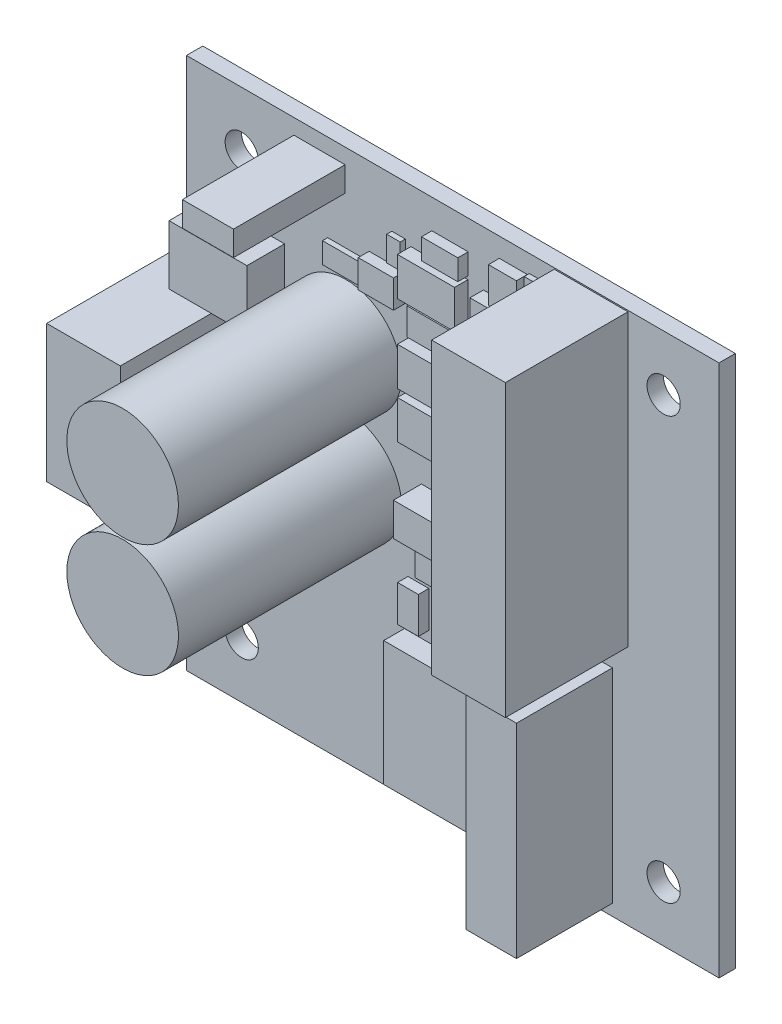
SolidWorks part; units mm, degrees
ref_plane "Front Plane" through (0, 0, 0) normal (0, 0, 1) x (1, 0, 0)
ref_plane "Top Plane" through (0, 0, 0) normal (0, 1, 0) x (1, 0, 0)
ref_plane "Right Plane" through (0, 0, 0) normal (1, 0, 0) x (0, 0, -1)
imported_body "10020689ra1_valve_actuator-1-surface1" [suppressed]
imported_body "MOLEX_705434PIN_705430003-1-surface1" [suppressed]
imported_body "MOLEX_705434PIN_705430003-2-surface1"
imported_body "RESC3225X60N_CRCW121051R0JNEA-1-surface1"
imported_body "TE_872242PIN_872242_SYMMOD1-1-surface1"
imported_body "TE_872242PIN_872242_SYMMOD1-2-surface1"
imported_body "SOIC127P594X3638N_HCPL0701-1-surface1"
imported_body "RESC2012X50N_CRCW0805100RJNEA-1-surface1"
imported_body "RESC2012X50N_CRCW0805100RJNEA-2-surface1"
imported_body "RESC2012X50N_CRCW0805100RJNEA-3-surface1"
imported_body "SOT65P205X1053N_132_BSS138W7F-1-surface1"
imported_body "SOT65P205X1053N_132_BSS138W7F-2-surface1"
imported_body "SOT65P205X1053N_132_BSS138W7F-3-surface1"
imported_body "SOP50P310X908N_SN74AUP1G74DCUR-1-surface1"
imported_body "SOP65P400X1308N_SN74AUP1G99DCTR_SYMMOD2-1-surface1"
imported_body "SOP65P400X1308N_SN74AUP1G99DCTR_SYMMOD2-2-surface1"
imported_body "SOP65P400X1308N_SN74AUP1G99DCTR_SYMMOD2-3-surface1"
imported_body "SOP65P400X1308N_SN74AUP1G99DCTR_SYMMOD3-1-surface1"
imported_body "SOP65P400X1308N_SN74AUP1G99DCTR_SYMMOD1-1-surface1"
imported_body "SOT65P280X1008N_LTC2934ITS81#TRMPBF-1-surface1"
imported_body "SOT65P280X1008N_LT3008ETS833#TRMPBF-1-surface1"
imported_body "DIOM5336X262N_SMBJ22A13F-1-surface1"
imported_body "DIOM5336X262N_SMBJ50A13F-1-surface1"
imported_body "DIOM5336X262N_SMBJ50A13F-2-surface1"
imported_body "CAPC1608X87N_C0603C104K5RAC-1-surface1"
imported_body "CAPC1608X87N_C0603C104K5RAC-2-surface1"
imported_body "CAPC1608X87N_C0603C104K5RAC-3-surface1"
imported_body "CAPC1608X87N_C0603C104K5RAC-4-surface1"
imported_body "SOT95P280X1005N_LT6003HS5#TRMPBF-1-surface1"
imported_body "CAPC2012X100N_C0805C105K4RAC-1-surface1"
imported_body "CAPC2012X100N_C0805C105K4RAC-2-surface1"
imported_body "CAPC2012X100N_C0805C105K4RAC-3-surface1"
imported_body "CAPC2012X100N_C0805C105K4RAC-4-surface1"
imported_body "CAPC2012X100N_C0805C105K4RAC-5-surface1"
imported_body "SOT92P240X120R3N_ACX_BAS197F-1-surface1"
imported_body "SOT92P240X120R3N_ACX_BAS197F-2-surface1"
imported_body "SOT92P240X120R3N_ACX_ZLLS1000TA-1-surface1"
imported_body "IND_MSS6132_MSS6132183MLB-1-surface1"
imported_body "CAPC2012X110N_C0805C474K5RAC-1-surface1"
imported_body "RESC1608X50N_CRCW060336K0JNEA-1-surface1"
imported_body "RESC1608X50N_CRCW060336K0JNEA-2-surface1"
imported_body "RESC1608X50N_CRCW060336K0JNEA-3-surface1"
imported_body "RESC1608X50N_CRCW0603330KJNEA-1-surface1"
imported_body "RESC1608X50N_CRCW06031M00JNEA-1-surface1"
imported_body "RESC1608X50N_CRCW060310K0JNEA-1-surface1"
imported_body "RESC1608X50N_CRCW060310K0JNEA-2-surface1"
imported_body "RESC1608X50N_CRCW0603154KFKEA-1-surface1"
imported_body "RESC1608X50N_CRCW06031M00FKEA-1-surface1"
imported_body "RESC1608X50N_CRCW06031M00FKEA-2-surface1"
imported_body "RESC1608X50N_CRCW06031M00FKEA-3-surface1"
imported_body "RESC1608X50N_CRCW06031M00FKEA-4-surface1"
imported_body "RESC1608X50N_CRCW060342K2FKEA-1-surface1"
imported_body "RESC1608X50N_CRCW06030000Z0EA-1-surface1"
imported_body "RESC1608X50N_CRCW0603100RJNEA-1-surface1"
imported_body "RESC1608X50N_CRCW0603562KFKEA-1-surface1"
imported_body "RESC1608X50N_CRCW060335K7FKEA-1-surface1"
imported_body "SOP50P490X11011N_MSEG_LT3991EMSE5#PBF-1-surface1"
imported_body "DIOM5336X250N_S1AB13F-1-surface1"
imported_body "IND_ACM4520_ACM45209012PT000-1-surface1"
imported_body "CAPC3325X270N_C1210X475K5RACTU-1-surface1"
imported_body "CAPC3325X270N_C1210X475K5RACTU-2-surface1"
imported_body "CAPC3325X270N_C1210X475K5RACTU-3-surface1"
imported_body "INDC1608X95N_MMZ1608S601A-1-surface1"
imported_body "CAPPRD500W60D1000H2150P_ESHSR0005C0002R7-1-surface1"
imported_body "CAPPRD500W60D1000H2150P_ESHSR0005C0002R7-2-surface1"
imported_body "TO127P1054X2008N_BD6212HFPTR-1-surface1"
imported_body "MOLEX_7054310PIN_0705430009-1-surface1"
imported_body "TE_14450945PIN_214450945-1-surface1"
imported_body "SOT95P280X1453N_132_SL353LT-1-surface1" [suppressed]
imported_body "SOT95P280X1453N_132_SL353LT-2-surface1" [suppressed]
sketch "Sketch3" plane through (0, 0, 0) normal (0, 0, 1) x (1, 0, 0)
  line L0 (28.956, 15.9893) -> (28.956, 0)
  line L1 (28.956, 0) -> (0, 0)
  line L16 (9.1313, 25.908) -> (9.1313, 41.783)
  line L17 (9.1313, 41.783) -> (0, 41.783)
  line L18 (0, 41.783) -> (0, 0)
  line L23 (28.956, 15.9893) -> (19.05, 15.9893)
  circle A1 centre (4.6736, 13.9954) radius 1.6002
  arc A2 (9.1313, 25.908) -> (19.05, 15.9893) centre (19.05, 25.908) ccw
  circle A4 centre (4.6736, 37.8206) radius 1.6002
  circle A9 centre (22.225, 2.667) radius 0.5461
  circle A10 centre (19.685, 2.667) radius 0.5461
  circle A11 centre (17.145, 2.667) radius 0.5461
  circle A12 centre (14.605, 2.667) radius 0.5461
extrude "Boss-Extrude2" [suppressed] add sketch "Sketch3" along normal blind 1.5748
sketch "Sketch4" plane through (0, 0, 0) normal (0, 0, 1) x (1, 0, 0)
  line L1 (28.9687, 51.308) -> (80.264, 51.308)
  line L2 (28.9687, 51.308) -> (28.9687, 0)
  line L3 (28.9687, 0) -> (80.264, 0)
  line L4 (80.264, 51.308) -> (80.264, 0)
  circle A33 centre (74.93, 45.974) radius 1.6002
  circle A34 centre (67.183, 48.641) radius 0.5461
  circle A35 centre (67.183, 46.101) radius 0.5461
  circle A36 centre (67.183, 43.561) radius 0.5461
  circle A37 centre (67.183, 41.021) radius 0.5461
  circle A38 centre (67.183, 38.481) radius 0.5461
  circle A39 centre (67.183, 35.941) radius 0.5461
  circle A40 centre (67.183, 33.401) radius 0.5461
  circle A41 centre (67.183, 30.861) radius 0.5461
  circle A42 centre (67.183, 28.321) radius 0.5461
  circle A43 centre (67.183, 25.781) radius 0.5461
  circle A44 centre (67.818, 19.1364) radius 1.2065
  circle A45 centre (67.818, 16.9215) radius 0.5334
  circle A46 centre (67.818, 13.9217) radius 0.5334
  circle A47 centre (67.818, 10.922) radius 0.5334
  circle A48 centre (67.818, 7.9223) radius 0.5334
  circle A49 centre (67.818, 4.9225) radius 0.5334
  circle A50 centre (67.818, 2.7076) radius 1.2065
  circle A51 centre (74.93, 5.334) radius 1.6002
  circle A52 centre (34.29, 5.334) radius 1.6002
  circle A53 centre (32.004, 11.938) radius 0.4826
  circle A54 centre (32.004, 14.478) radius 0.4826
  circle A55 centre (31.623, 23.622) radius 0.5461
  circle A56 centre (31.623, 26.162) radius 0.5461
  circle A57 centre (31.623, 28.702) radius 0.5461
  circle A58 centre (31.623, 31.242) radius 0.5461
  circle A59 centre (41.8236, 34.925) radius 0.4318
  circle A60 centre (46.8224, 34.925) radius 0.4318
  circle A61 centre (46.8224, 24.003) radius 0.4318
  circle A62 centre (41.8236, 24.003) radius 0.4318
  circle A63 centre (34.29, 45.974) radius 1.6002
  circle A64 centre (40.513, 48.641) radius 0.4826
  circle A65 centre (43.053, 48.641) radius 0.4826
extrude "Boss-Extrude3" add sketch "Sketch4" along normal blind 1.5748
ref_plane "Plane1" through (0, 25.654, 0) normal (0, -1, 0) x (-1, 0, 0)
ref_plane "Plane2" through (54.6164, 0, 0) normal (1, 0, 0) x (0, 0, -1)
